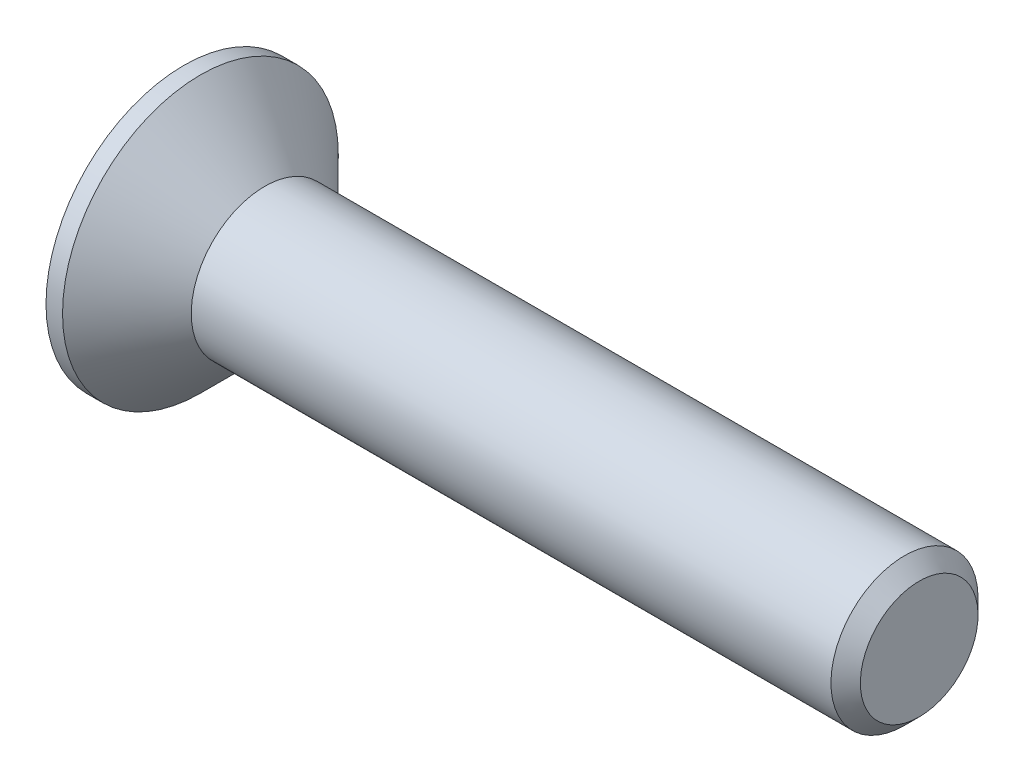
SolidWorks part; units mm, degrees
ref_plane "Front Plane" through (0, 0, 0) normal (0, 0, 1) x (1, 0, 0)
ref_plane "Top Plane" through (0, 0, 0) normal (0, 1, 0) x (1, 0, 0)
ref_plane "Right Plane" through (0, 0, 0) normal (1, 0, 0) x (0, 0, -1)
sketch "Sketch1" plane through (0, 0, 0) normal (0, 0, 1) x (1, 0, 0)
  line L1 (-2.2, 3.75) -> (-2.2, 0)
  line L2 (-2.2, 0) -> (17.8, 0)
  line L3 (17.8, 0) -> (17.8, 2)
  line L4 (17.8, 2) -> (0, 2)
  line L5 (-2.2, 3.75) -> (-1.75, 3.75)
  line L6 (-1.75, 3.75) -> (0, 2)
  dimension "D1" = 2
  dimension "D2" = 45
  dimension "D3" = 2.2
  dimension "D4" = 20
  dimension "D5" = 3.75
revolve "Revolve1" add sketch "Sketch1" angle 360 about L2
chamfer "Chamfer1" distance 0.4 angle 45 1 edges at (17.8, -2, 0)
sketch "Sketch2" plane through (-2.2, 0, 0) normal (-1, 0, 0) x (0, 0, 1)
  line L0 (-0.55, 2.2) -> (0.55, 2.2)
  line L1 (0.55, 2.2) -> (0.55, 0.55)
  line L2 (0.55, 0.55) -> (2.2, 0.55)
  line L3 (2.2, 0.55) -> (2.2, -0.55)
  line L4 (2.2, -0.55) -> (0.55, -0.55)
  line L5 (0.55, -0.55) -> (0.55, -2.2)
  line L6 (0.55, -2.2) -> (-0.55, -2.2)
  line L7 (-0.55, -2.2) -> (-0.55, -0.55)
  line L8 (-0.55, -0.55) -> (-2.2, -0.55)
  line L9 (-2.2, -0.55) -> (-2.2, 0.55)
  line L10 (-2.2, 0.55) -> (-0.55, 0.55)
  line L11 (-0.55, 0.55) -> (-0.55, 2.2)
  point P2 (0, 2.2)
  point P14 (0, -2.2)
  point P15 (2.2, 0)
  point P16 (-2.2, 0)
  dimension "D1" = 4.4
  dimension "D2" = 1.1
extrude "Cut-Extrude1" cut sketch "Sketch2" against normal blind 1.9
